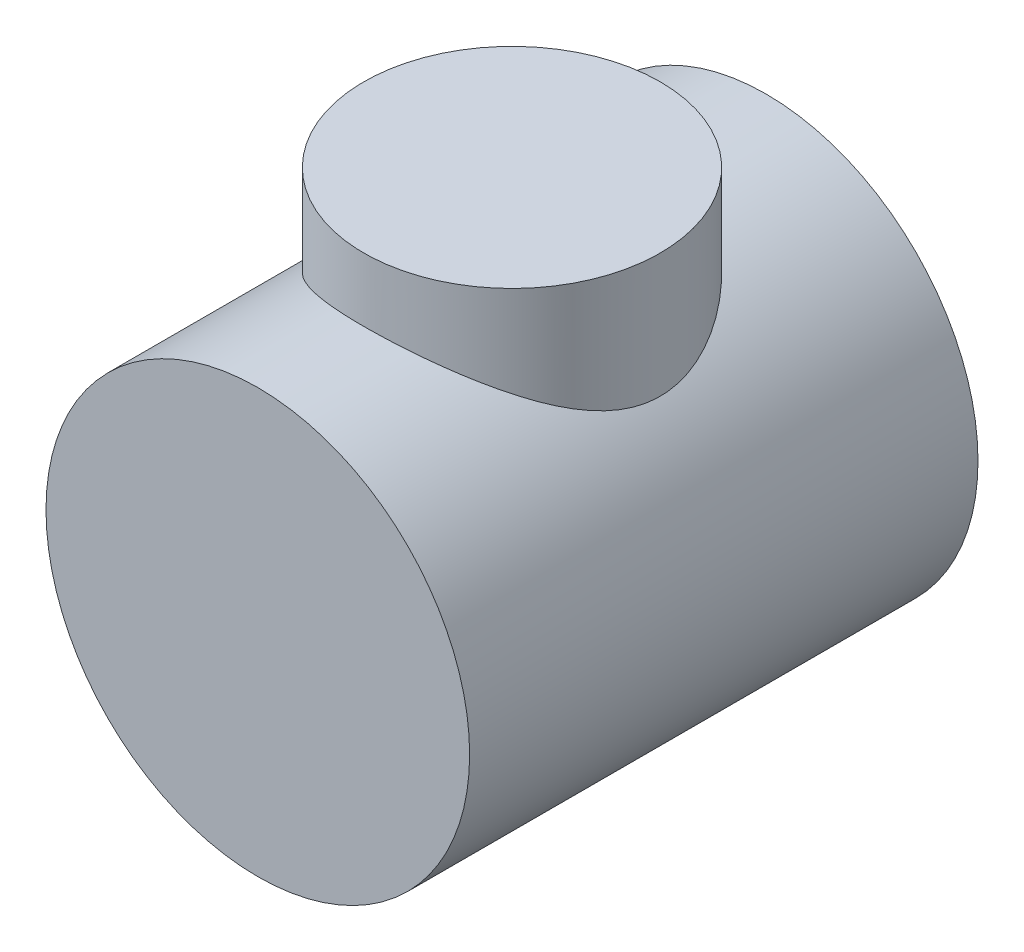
SolidWorks part; units mm, degrees
ref_plane "前视基准面" through (0, 0, 0) normal (0, 0, 1) x (1, 0, 0)
ref_plane "上视基准面" through (0, 0, 0) normal (0, 1, 0) x (1, 0, 0)
ref_plane "右视基准面" through (0, 0, 0) normal (1, 0, 0) x (0, 0, -1)
sketch "草图1" plane through (0, 0, 0) normal (0, 0, 1) x (1, 0, 0)
  circle A0 centre (0, 0) radius 50
  dimension "D1" = 50
extrude "拉伸1" add sketch "草图1" along normal mid plane 120
sketch "草图2" plane through (0, 0, 0) normal (0, 0, 1) x (1, 0, 0)
  line L0 (0, 0) -> (0, 67.4649) construction
  line L1 (0, 65) -> (-35, 65)
  line L2 (-35, 65) -> (-35, 35.7071)
  line L3 (0, 65) -> (0, 50)
  line L4 (0, 50) -> (0.1596, 50.2235)
  circle A0 centre (0, 0) radius 50 construction
  arc A1 (-35, 35.7071) -> (0, 50) centre (0, 0) cw
  dimension "D1" = 35
  dimension "D2" = 15
revolve "旋转1" add sketch "草图2" angle 360 about L0
